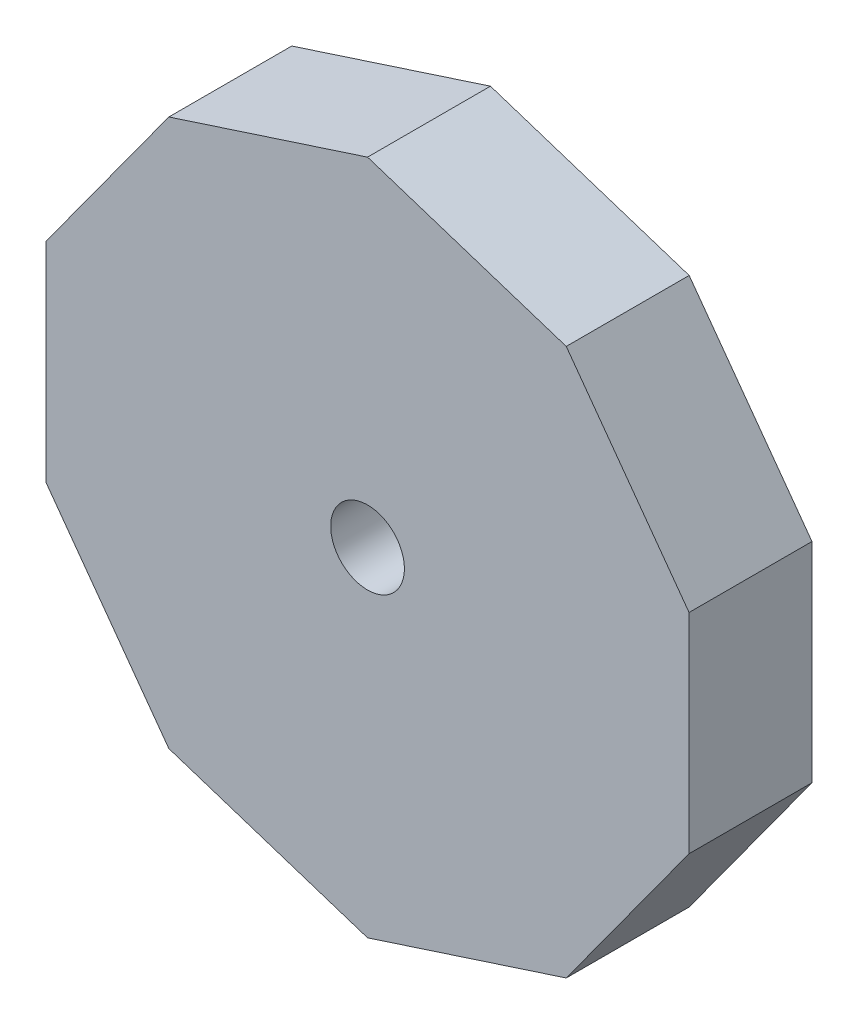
SolidWorks part; units mm, degrees
ref_plane "前基準面" through (0, 0, 0) normal (0, 0, 1) x (1, 0, 0)
ref_plane "上基準面" through (0, 0, 0) normal (0, 1, 0) x (1, 0, 0)
ref_plane "右基準面" through (0, 0, 0) normal (1, 0, 0) x (0, 0, -1)
sketch "草圖1" plane through (0, 0, 0) normal (0, 0, 1) x (1, 0, 0)
  line L11 (52.3206, 17) -> (32.3359, 44.5066)
  line L12 (32.3359, 44.5066) -> (0, 55.0132)
  line L13 (0, 55.0132) -> (-32.3359, 44.5066)
  line L14 (-32.3359, 44.5066) -> (-52.3206, 17)
  line L15 (-52.3206, 17) -> (-52.3206, -17)
  line L16 (-52.3206, -17) -> (-32.3359, -44.5066)
  line L17 (-32.3359, -44.5066) -> (0, -55.0132)
  line L18 (0, -55.0132) -> (32.3359, -44.5066)
  line L19 (32.3359, -44.5066) -> (52.3206, -17)
  line L20 (52.3206, -17) -> (52.3206, 17)
  circle A0 centre (0, 0) radius 52.3206 construction
  circle A1 centre (0, 0) radius 6
  dimension "D2" = 12
  dimension "D1" = 34
extrude "填料-伸長1" add sketch "草圖1" along normal blind 20
